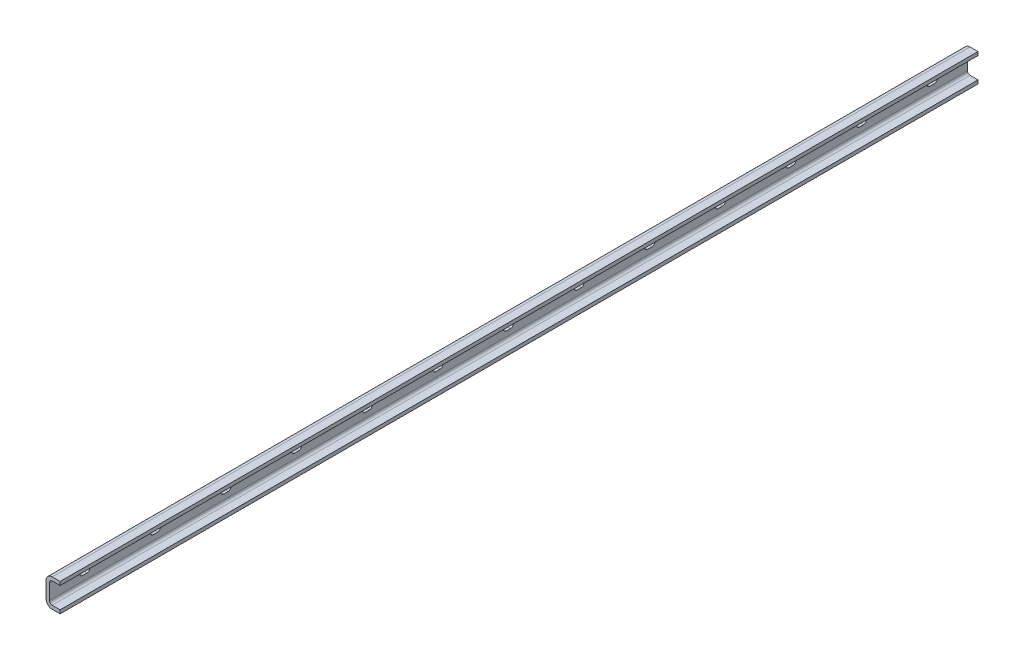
SolidWorks part; units mm, degrees
ref_plane "Front Plane" through (0, 0, 0) normal (0, 0, 1) x (1, 0, 0)
ref_plane "Top Plane" through (0, 0, 0) normal (0, 1, 0) x (1, 0, 0)
ref_plane "Right Plane" through (0, 0, 0) normal (1, 0, 0) x (0, 0, -1)
sketch "Sketch1" plane through (0, 0, 0) normal (0, 0, 1) x (1, 0, 0)
  line L0 (16, 11.9) -> (16, 15.9)
  line L1 (16, 15.9) -> (7, 15.9)
  line L2 (0, 8.9) -> (0, -8.9)
  line L3 (7, -15.9) -> (16, -15.9)
  line L4 (16, -15.9) -> (16, -11.9)
  line L5 (16, -11.9) -> (7, -11.9)
  line L6 (4, -8.9) -> (4, 8.9)
  line L7 (7, 11.9) -> (16, 11.9)
  arc A0 (7, 15.9) -> (0, 8.9) centre (7, 8.9) ccw
  arc A1 (0, -8.9) -> (7, -15.9) centre (7, -8.9) ccw
  arc A2 (7, -11.9) -> (4, -8.9) centre (7, -8.9) cw
  arc A3 (4, 8.9) -> (7, 11.9) centre (7, 8.9) cw
  dimension "D1" = 7
  dimension "D2" = 3
  dimension "D3" = 16
  dimension "D4" = 11.9
  dimension "D5" = 11.9
extrude "Extrude1" add sketch "Sketch1" against normal blind 1040
sketch "Sketch2" plane through (4, 0, 0) normal (1, 0, 0) x (0, 0, -1)
  line L0 (37.5, 0) -> (42.5, 0) construction
  line L1 (37.5, 3) -> (42.5, 3)
  line L2 (37.5, -3) -> (42.5, -3)
  arc A0 (37.5, 3) -> (37.5, -3) centre (37.5, 0) ccw
  arc A1 (42.5, 3) -> (42.5, -3) centre (42.5, 0) cw
  point P7 (40, 0)
  dimension "D1" = 5
  dimension "D2" = 6
  dimension "D3" = 40
extrude "Extrude2" cut sketch "Sketch2" against normal through all
pattern_linear "LPattern1" count 13 spacing 80 along (0, 0, -1) of "Extrude2"
